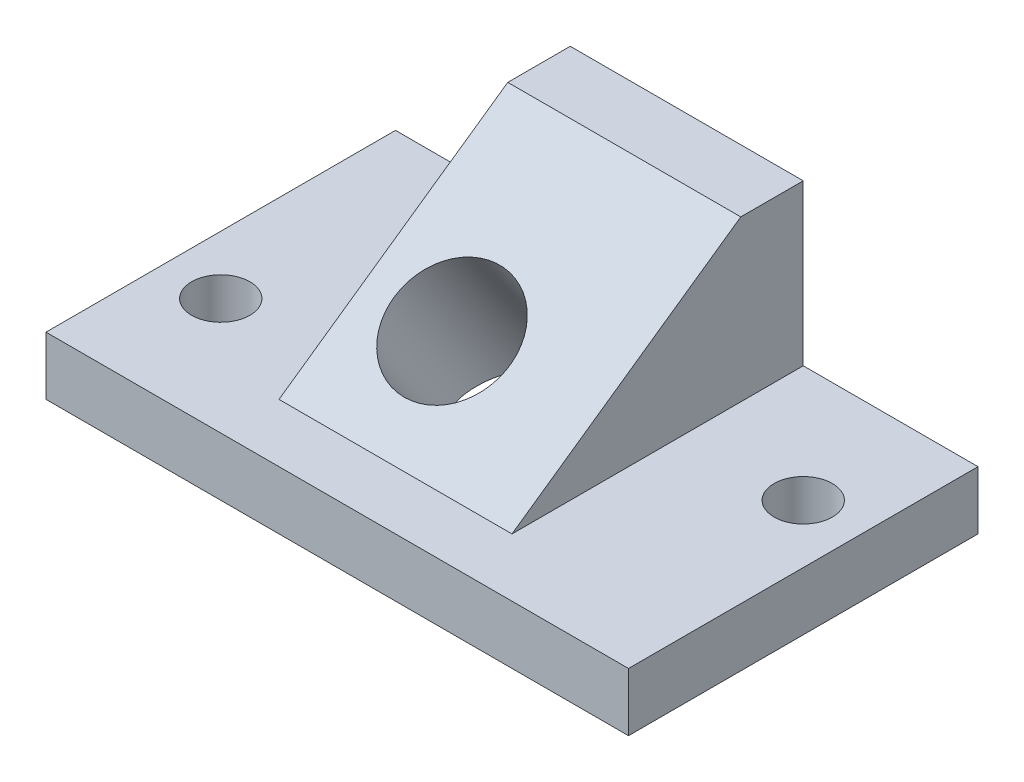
SolidWorks part; units mm, degrees
other "DetailItem5"
other "DetailItem6"
other "DetailItem7"
ref_plane "Front" through (0, 0, 0) normal (0, 0, 1) x (1, 0, 0)
ref_plane "Top" through (0, 0, 0) normal (0, 1, 0) x (1, 0, 0)
ref_plane "Right" through (0, 0, 0) normal (1, 0, 0) x (0, 0, -1)
sketch "Sketch1" plane through (0, 0, 0) normal (0, 1, 0) x (1, 0, 0)
  line L0 (-63.5, -38.1) -> (63.5, -38.1)
  line L1 (-63.5, -38.1) -> (-63.5, 38.1)
  line L2 (63.5, 38.1) -> (-63.5, 38.1)
  line L3 (63.5, 38.1) -> (63.5, -38.1)
  line L4 (-63.5, 38.1) -> (63.5, -38.1) construction
  dimension "D1" = 127
  dimension "D2" = 76.2
extrude "Base-Extrude" add sketch "Sketch1" along normal blind 12.7
sketch "Sketch3" plane through (0, 0, 0) normal (1, 0, 0) x (0, 0, -1)
  line L0 (-25.4, 12.7) -> (24.4781, 47.625)
  line L1 (24.4781, 47.625) -> (38.1, 47.625)
  line L2 (38.1, 47.625) -> (38.1, 12.7)
  line L3 (38.1, 12.7) -> (-25.4, 12.7)
  line L4 (-38.1, 12.7) -> (-38.1, 0) construction
  line L5 (38.1, 12.7) -> (-38.1, 12.7) construction
  dimension "D1" = 34.925
  dimension "D2" = 35
  dimension "D3" = 12.7
extrude "Boss-Extrude2" add sketch "Sketch3" against normal mid plane 50.8
sketch "Sketch4" plane through (65.6996, 12.7, 10.1892) normal (0, 1, 0) x (-1, 0, 0)
  line L0 (129.1996, 27.9108) -> (2.1996, 27.9108) construction
  line L1 (2.1996, -48.2892) -> (2.1996, 27.9108) construction
  line L2 (129.1996, 27.9108) -> (129.1996, -48.2892) construction
  line L3 (129.1996, 27.9108) -> (2.1996, 27.9108) construction
  circle A0 centre (14.8996, -22.8892) radius 6.35
  circle A1 centre (116.4996, 2.5108) radius 6.35
  dimension "D1" = 12.7
  dimension "D2" = 12.7
  dimension "D3" = 25.4
  dimension "D4" = 12.7
  dimension "D5" = 50.8
extrude "Cut-Extrude1" cut sketch "Sketch4" against normal through all
sketch "Sketch5" plane through (0, 20.4559, 14.3234) normal (0, 0.8192, 0.5736) x (-1, 0, 0)
  line L0 (25.4, 13.522) -> (25.4, -47.3678) construction
  line L1 (25.4, -47.3678) -> (-25.4, -47.3678) construction
  circle A0 centre (6.35, -9.2678) radius 12.7
  dimension "D3" = 25.4
  dimension "D1" = 19.05
  dimension "D2" = 38.1
extrude "Cut-Extrude2" cut sketch "Sketch5" against normal through all
